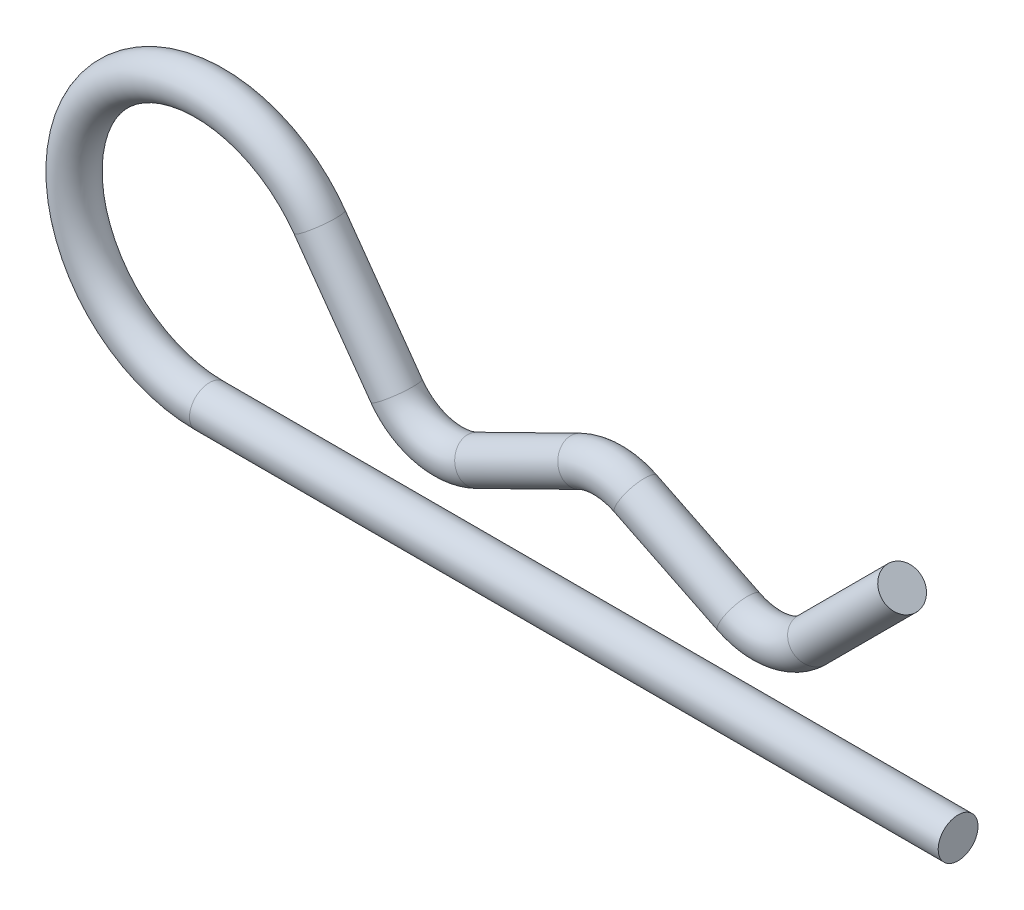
SolidWorks part; units mm, degrees
ref_plane "Plan de face" through (0, 0, 0) normal (0, 0, 1) x (1, 0, 0)
ref_plane "Plan de dessus" through (0, 0, 0) normal (0, 1, 0) x (1, 0, 0)
ref_plane "Plan de droite" through (0, 0, 0) normal (1, 0, 0) x (0, 0, -1)
imported_body "Importée3"
sketch "Esquisse1" plane through (-35, 0, 0) normal (1, 0, 0) x (0, 0, -1)
  circle A0 centre (0, -9) radius 1.25
extrude "Boss.-Extru.1" add sketch "Esquisse1" along normal blind 47
